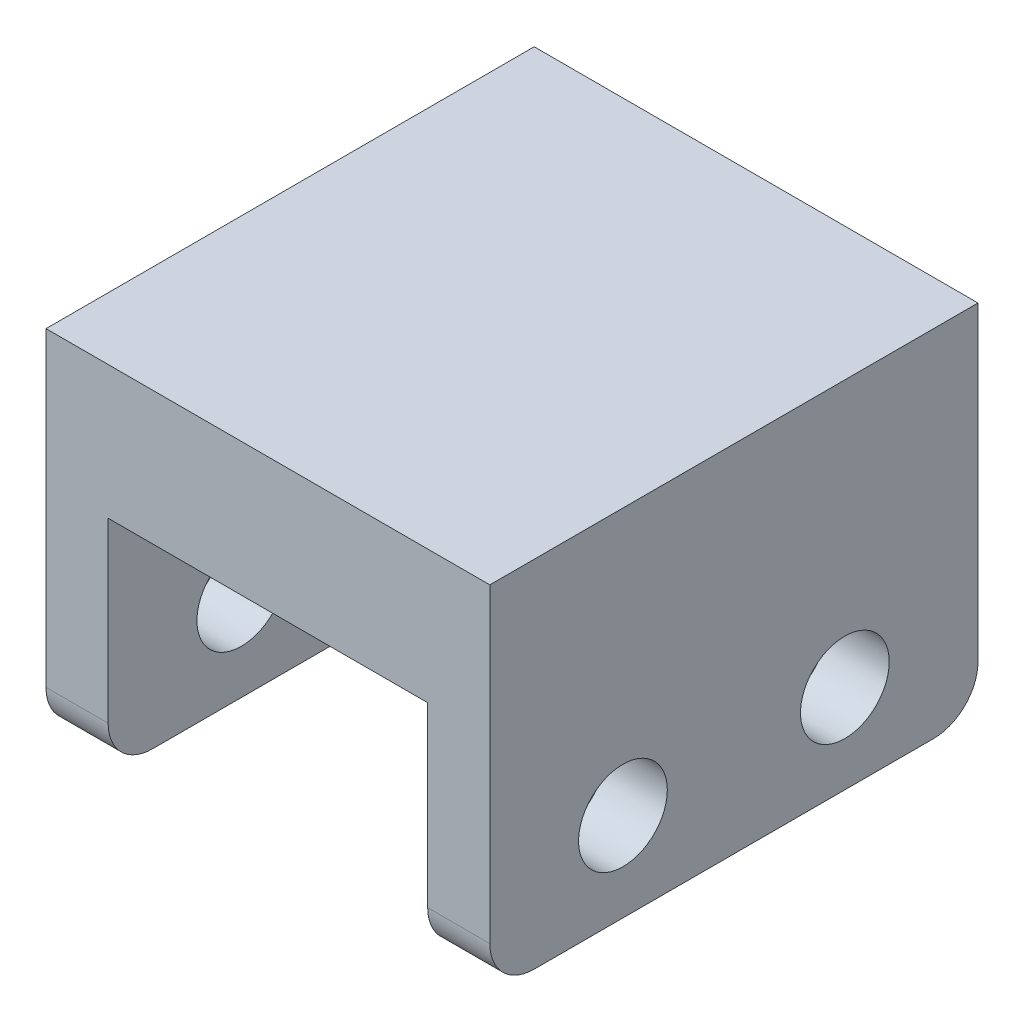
SolidWorks part; units mm, degrees
ref_plane "Front" through (0, 0, 0) normal (0, 0, 1) x (1, 0, 0)
ref_plane "Top" through (0, 0, 0) normal (0, 1, 0) x (1, 0, 0)
ref_plane "Right" through (0, 0, 0) normal (1, 0, 0) x (0, 0, -1)
sketch "Sketch1" plane through (0, 0, 0) normal (0, 1, 0) x (1, 0, 0)
  line L1 (-25, 27.5) -> (25, 27.5)
  line L2 (-25, 27.5) -> (-25, -27.5)
  line L3 (-25, -27.5) -> (25, -27.5)
  line L4 (25, 27.5) -> (25, -27.5)
  line L5 (-25, 27.5) -> (25, -27.5) construction
  line L6 (-25, -27.5) -> (25, 27.5) construction
  point P0 (0, 0)
  dimension "D1" = 50
  dimension "D2" = 55
extrude "Boss-Extrude1" add sketch "Sketch1" along normal blind 40
fillet "Fillet1" radius 5 2 edges at (0, 0, -27.5) (0, 0, 27.5)
sketch "Sketch2" plane through (0, 0, 0) normal (0, -1, 0) x (1, 0, 0)
  line L0 (25, 22.5) -> (25, -22.5) construction
  line L1 (-18, -27.5) -> (18, -27.5)
  line L2 (-18, -27.5) -> (-18, 27.5)
  line L3 (-18, 27.5) -> (18, 27.5)
  line L4 (18, -27.5) -> (18, 27.5)
  line L5 (-18, -27.5) -> (18, 27.5) construction
  line L6 (-18, 27.5) -> (18, -27.5) construction
  line L8 (-25, 27.5) -> (25, 27.5) construction
  point P0 (0, 0)
  dimension "D1" = 7
extrude "Cut-Extrude1" cut sketch "Sketch2" against normal blind 25
sketch "Sketch3" plane through (25, 0, 0) normal (1, 0, 0) x (0, 0, -1)
  line L0 (0, 0) -> (0, 24.2772) construction
  line L1 (-22.5, 0) -> (22.5, 0) construction
  circle A0 centre (-12.5, 10) radius 5
  circle A1 centre (12.5, 10) radius 5
  dimension "D1" = 10
  dimension "D2" = 10
  dimension "D3" = 10
  dimension "D4" = 25
extrude "Cut-Extrude2" cut sketch "Sketch3" against normal blind 61
